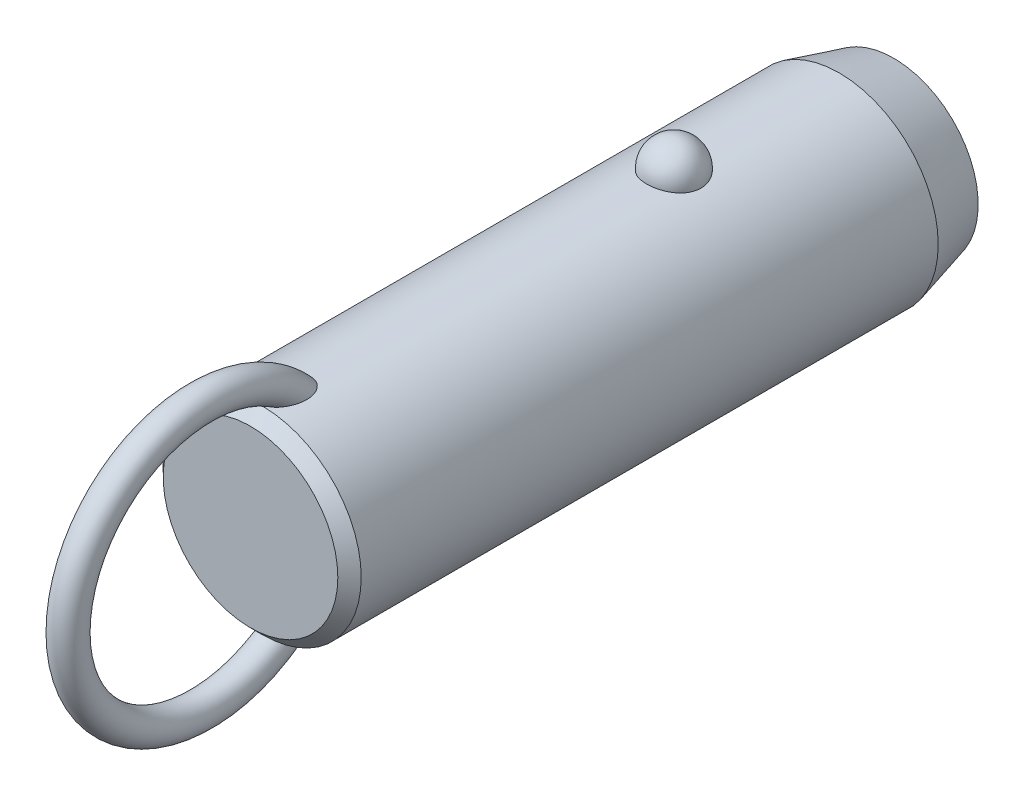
SolidWorks part; units mm, degrees
ref_plane "Front Plane" through (0, 0, 0) normal (0, 0, 1) x (1, 0, 0)
ref_plane "Top Plane" through (0, 0, 0) normal (0, 1, 0) x (1, 0, 0)
ref_plane "Right Plane" through (0, 0, 0) normal (1, 0, 0) x (0, 0, -1)
sketch "Sketch2" plane through (0, 0, 0) normal (0, 0, 1) x (1, 0, 0)
  circle A0 centre (0, 0) radius 12.7
  point P3 (0, 12.7)
  dimension "D1" = 25.4
extrude "Boss-Extrude1" add sketch "Sketch2" along normal blind 38.1
sketch "Sketch3" plane through (0, 0, 0) normal (0, 0, -1) x (-1, 0, 0)
  circle A0 centre (0, 0) radius 12.7
  dimension "D1" = 25.4
extrude "Boss-Extrude2" add sketch "Sketch3" along normal blind 31.7
chamfer "Chamfer1" distance 7 angle 15 1 edges at (-12.7, 0, -31.7)
sketch "Sketch12" plane through (0, 0, 0) normal (1, 0, 0) x (0, 0, -1)
  line L0 (-38.1, 12.7) -> (-38.1, -12.7) construction
  point P0 (-38.1, 0)
sketch "Sketch13" plane through (0, 0, 0) normal (1, 0, 0) x (0, 0, -1)
  circle A0 centre (-57.15, 0) radius 19.05
  point P2 (-38.1, 0)
  dimension "D1" = 38.1
sketch "Sketch14" plane through (0, 0, 0) normal (0, 1, 0) x (1, 0, 0)
  circle A0 centre (0, -40.1) radius 2
  point P2 (0, -38.1)
  dimension "D1" = 4
sweep "Sweep1" add profiles "Sketch14" path "Sketch13"
sketch "Sketch15" plane through (0, 0, 38.1) normal (0, 0, 1) x (1, 0, 0)
  circle A0 centre (0, 0) radius 12.7
  dimension "D1" = 25.4
extrude "Boss-Extrude3" add sketch "Sketch15" along normal blind 12.7
chamfer "Chamfer2" distance 1.5 angle 45 1 edges at (12.7, 0, 50.8)
sketch "Sketch18" plane through (0, 0, 0) normal (1, 0, 0) x (0, 0, -1)
  line L0 (24.7, 12.7) -> (-42.951, 12.7) construction
  line L1 (3.5, 16.2) -> (3.5, 9.2)
  line L2 (-42.951, -12.7) -> (24.7, -12.7) construction
  arc A0 (3.5, 16.2) -> (3.5, 9.2) centre (3.5, 12.7) ccw
  point P4 (0, 12.7)
  dimension "D1" = 28.9
revolve "Revolve1" add sketch "Sketch18" angle 360 about L1
